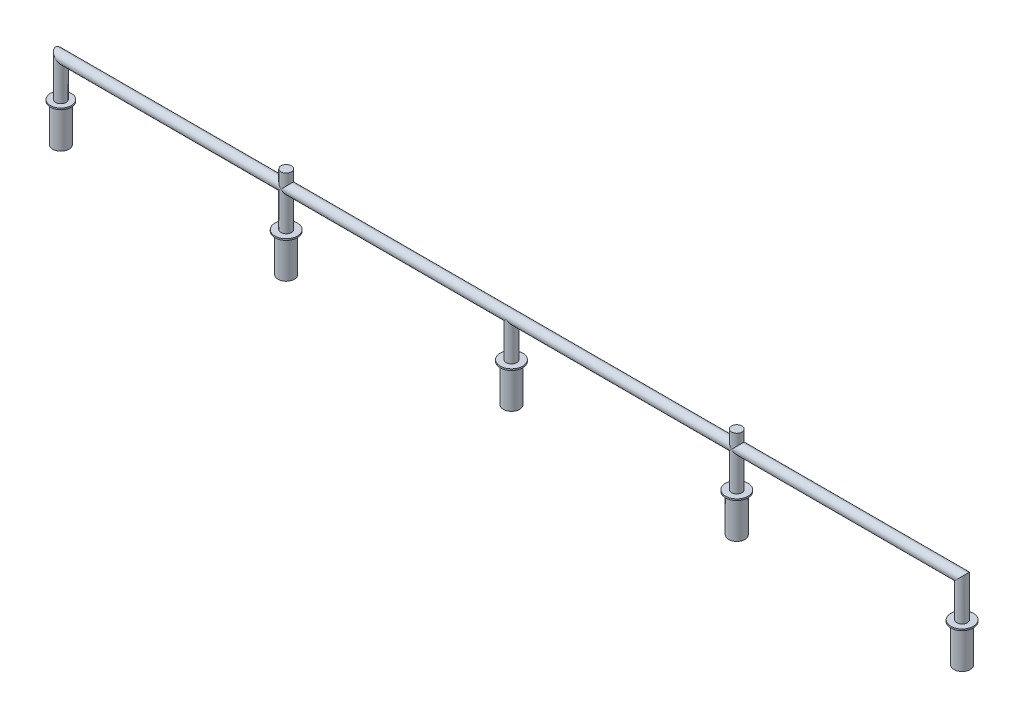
SolidWorks part; units mm, degrees
ref_plane "Alzado" through (0, 0, 0) normal (0, 0, 1) x (1, 0, 0)
ref_plane "Planta" through (0, 0, 0) normal (0, 1, 0) x (1, 0, 0)
ref_plane "Vista lateral" through (0, 0, 0) normal (1, 0, 0) x (0, 0, -1)
sketch "Croquis1" plane through (0, 0, 0) normal (0, 0, 1) x (1, 0, 0)
  line L0 (-600, 0) -> (600, 0)
  line L1 (-600, 0) -> (-600, -50)
  line L2 (600, 0) -> (600, -100)
  dimension "D1" = 1200
  dimension "D2" = 600
  dimension "D3" = 50
  dimension "D4" = 100
sweep "Barrer1" add path "Croquis1" parameters "D3"=14
sketch "Croquis12" plane through (0, 0, 0) normal (0, 0, 1) x (1, 0, 0)
  line L0 (-300, 0) -> (-300, -100)
  line L1 (-450, 0) -> (-450, 20)
  line L6 (0, 0) -> (0, 100)
  dimension "D1" = 100
  dimension "D2" = 20
  dimension "D9" = 100
sweep "Barrer2" add path "Croquis12" parameters "D3"=14
sketch "Croquis94" plane through (0, 0, 0) normal (0, 0, 1) x (1, 0, 0)
  line L1 (-450, 0) -> (-450, 20)
  line L5 (-300, 0) -> (-300, 100)
  line L6 (0, -100) -> (0, 0)
  dimension "D2" = 20
  dimension "D5" = 150
  dimension "D6" = 100
  dimension "D7" = 300
  dimension "D9" = 100
sweep "Barrer3" add path "Croquis94" parameters "D3"=14
sketch "Croquis107" plane through (0, 0, 0) normal (0, 0, 1) x (1, 0, 0)
  line L0 (300, 0) -> (300, -100)
  line L1 (-450, 0) -> (-450, 20)
  line L2 (450, 0) -> (450, 20)
  dimension "D1" = 100
  dimension "D2" = 300
sketch "Croquis108" plane through (0, 0, 0) normal (0, 0, 1) x (1, 0, 0)
  line L1 (-300, 0) -> (-300, 20)
  line L2 (450, 0) -> (450, 20)
  dimension "D1" = 300
sketch "Croquis109" plane through (0, 0, 0) normal (0, 0, 1) x (1, 0, 0)
  line L0 (300, 0) -> (300, 20)
  line L1 (-450, 0) -> (-450, 20)
sweep "Barrer4" add path "Croquis107" parameters "D3"=14
sweep "Barrer5" add path "Croquis108" parameters "D3"=14
sweep "Barrer6" add path "Croquis109" parameters "D3"=14
sketch "Croquis128" plane through (0, -50, 0) normal (0, -1, 0) x (1, 0, 0)
  circle A0 centre (-600, 0) radius 14
  circle A1 centre (-300, 0) radius 15
  circle A2 centre (0, 0) radius 15
  circle A3 centre (300, 0) radius 15
  circle A4 centre (600, 0) radius 15
  dimension "D1" = 28
  dimension "D2" = 30
  dimension "D3" = 30
  dimension "D4" = 30
  dimension "D5" = 30
extrude "Saliente-Extruir1" add sketch "Croquis128" along normal blind 2
sketch "Croquis129" plane through (0, -52, 0) normal (0, -1, 0) x (1, 0, 0)
  circle A0 centre (-600, 0) radius 10.8625
extrude "Saliente-Extruir2" add sketch "Croquis129" along normal blind 50 separate body
pattern_linear "MatrizL1" count 5 spacing 300 along (1, 0, 0) of "Saliente-Extruir2"
